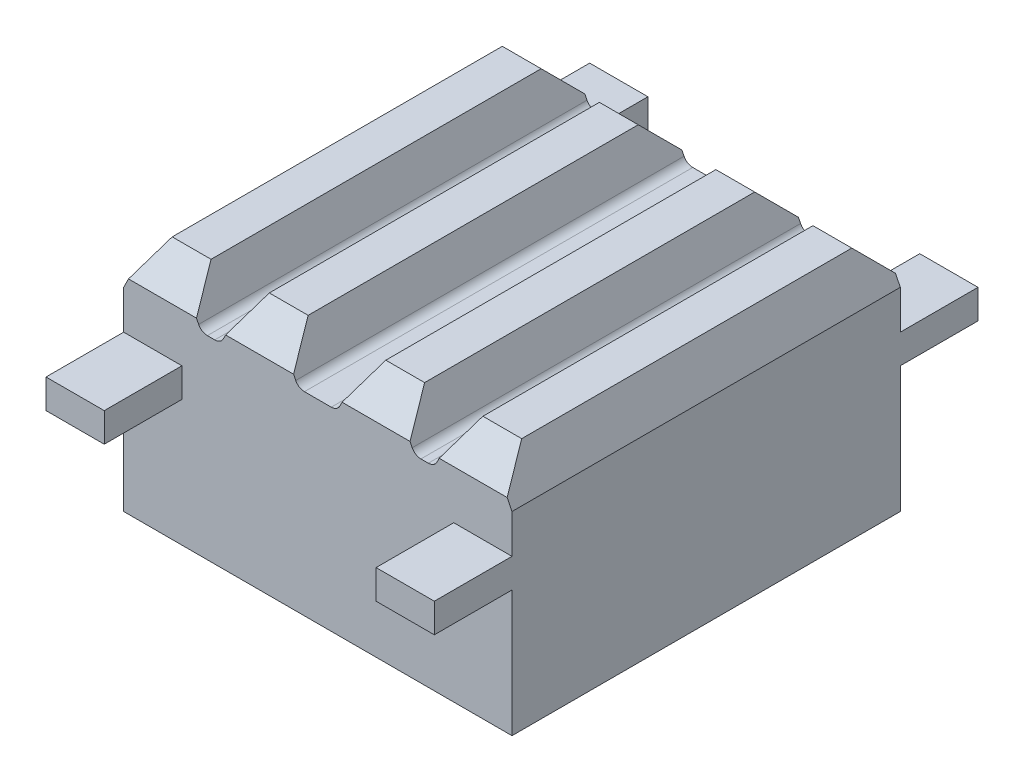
SolidWorks part; units mm, degrees
ref_plane "Plane1" through (0, 0, 0) normal (0, 0, 1) x (1, 0, 0)
ref_plane "Plane2" through (0, 0, 0) normal (0, 1, 0) x (1, 0, 0)
ref_plane "Plane3" through (0, 0, 0) normal (1, 0, 0) x (0, 0, -1)
sketch "Esquisse2" plane through (0, 0, 0) normal (0, 0, 1) x (1, 0, 0)
  line L0 (0, 0) -> (20, 0)
  line L1 (20, 0) -> (20, 10)
  line L2 (20, 10) -> (19, 12)
  line L3 (19, 12) -> (17, 12)
  line L4 (17, 12) -> (16, 10)
  line L5 (16, 10) -> (15, 10)
  line L6 (15, 10) -> (14, 12)
  line L7 (14, 12) -> (12, 12)
  line L8 (12, 12) -> (11, 10)
  line L9 (11, 10) -> (9, 10)
  line L10 (10, 0) -> (10, 12) construction
  line L11 (0, 10) -> (1, 12)
  line L12 (1, 12) -> (3, 12)
  line L13 (3, 12) -> (4, 10)
  line L14 (4, 10) -> (5, 10)
  line L15 (5, 10) -> (6, 12)
  line L16 (6, 12) -> (8, 12)
  line L17 (8, 12) -> (9, 10)
  line L18 (0, 10) -> (0, 0)
  point P22 (10, 10)
extrude "Base-Extrusion" add sketch "Esquisse2" along normal blind 20
chamfer "Chanfrein1" distance 1.5 angle 45
chamfer "Chanfrein2" distance 1.5 angle 45
fillet "Congé2" radius 0.5
sketch "Esquisse3" plane through (0, 0, 0) normal (0, -1, 0) x (1, 0, 0)
  line L0 (18, 2) -> (14, 2)
  line L1 (18, 2) -> (18, 18)
  line L2 (14, 18) -> (18, 18)
  line L3 (14, 14) -> (14, 2)
  line L4 (2, 18) -> (14, 18)
  line L5 (2, 18) -> (2, 14)
  line L6 (14, 14) -> (2, 14)
extrude "Enlèv. mat.-Extru.1" cut sketch "Esquisse3" against normal blind 4
fillet "Congé3" radius 1.5
fillet "Congé4" radius 1.5
fillet "Congé5" radius 1.5
sketch "Esquisse4" plane through (0, 0, 20) normal (0, 0, 1) x (1, 0, 0)
  line L0 (0, 8) -> (3, 8)
  line L1 (3, 6.5) -> (0, 6.5)
  line L2 (0, 6.5) -> (0, 8)
  line L3 (3, 8) -> (3, 6.5)
  line L4 (0, 10) -> (0, 0) construction
  line L7 (20, 8) -> (17, 8)
  line L8 (20, 8) -> (20, 6.5)
  line L9 (17, 6.5) -> (20, 6.5)
  line L10 (17, 6.5) -> (17, 8)
  line L11 (20, 0) -> (20, 10) construction
extrude "Boss.-Extru.1" add sketch "Esquisse4" along normal blind 4
sketch "Esquisse5" plane through (0, 0, 0) normal (0, 0, -1) x (-1, 0, 0)
  line L0 (-20, 8) -> (-17, 8)
  line L1 (-17, 8) -> (-17, 6.5)
  line L2 (-17, 6.5) -> (-20, 6.5)
  line L3 (-20, 6.5) -> (-20, 8)
  line L4 (0, 8) -> (-3, 8)
  line L5 (-3, 8) -> (-3, 6.5)
  line L6 (-3, 6.5) -> (0, 6.5)
  line L7 (0, 6.5) -> (0, 8)
extrude "Boss.-Extru.2" add sketch "Esquisse5" along normal blind 4
